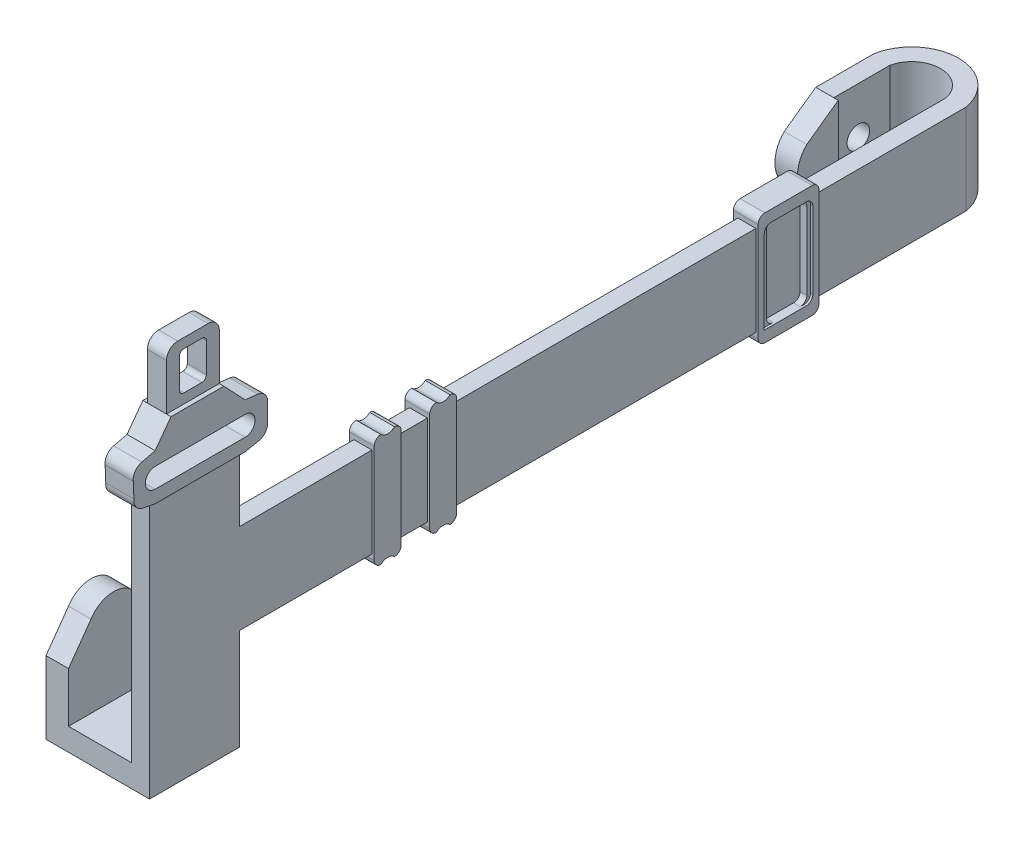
SolidWorks part; units mm, degrees
ref_plane "Alzado" through (0, 0, 0) normal (0, 0, 1) x (1, 0, 0)
ref_plane "Planta" through (0, 0, 0) normal (0, 1, 0) x (1, 0, 0)
ref_plane "Vista lateral" through (0, 0, 0) normal (1, 0, 0) x (0, 0, -1)
sketch "Croquis1" plane through (0, 0, 0) normal (0, 1, 0) x (1, 0, 0)
  line L1 (-25, 0) -> (-25, -25)
  line L2 (0, 0) -> (0, -362) construction
  line L3 (0, 0) -> (0, -362)
  arc A1 (-25, 0) -> (0, 0) centre (-12.5, -2.865) cw
  dimension "D1" = 25
  dimension "D2" = 362
  dimension "D3" = 25
extrude "Extruir-Lámina3" add sketch "Croquis1" along normal blind 40 thin
sketch "Croquis4" plane through (0, 0, 0) normal (0, -1, 0) x (1, 0, 0)
  line L0 (8, 362) -> (0, 362)
  line L1 (0, 362) -> (0, 322)
  line L2 (0, 362) -> (0, 0) construction
  line L3 (0, 322) -> (8, 322)
  line L4 (8, 362) -> (8, -0.7948) construction
  line L5 (8, 322) -> (8, 362)
  dimension "D1" = 40
extrude "Saliente-Extruir1" add sketch "Croquis4" along normal blind 34.88
sketch "Croquis9" plane through (8, 0, 0) normal (1, 0, 0) x (0, 0, -1)
  line L0 (-362, 40) -> (0.7948, 40) construction
  line L5 (-322, 0) -> (0.7948, 0) construction
  line L6 (-65.6135, 0) -> (-92.587, 0) construction
  line L11 (-68.6135, 45) -> (-89.587, 45)
  line L12 (-65.6135, 42) -> (-65.6135, -2)
  line L13 (-68.6135, -5) -> (-89.587, -5)
  line L14 (-92.587, 42) -> (-92.587, -2)
  line L15 (-58.2022, 40) -> (-121.8422, 40) construction
  line L16 (-65.6135, 45) -> (-92.587, -5) construction
  line L17 (-65.6135, -5) -> (-92.587, 45) construction
  line L18 (-212.9826, 40) -> (-273.7346, 40) construction
  line L19 (-71.3109, 40) -> (-86.8897, 40)
  line L20 (-68.3109, 37) -> (-68.3109, 3)
  line L21 (-71.3109, 0) -> (-89.8897, 0)
  line L22 (-89.8897, 37) -> (-89.8897, 0)
  line L24 (-238.5261, 42) -> (-238.5261, -2)
  line L26 (-226.5261, 42) -> (-226.5261, -2)
  line L28 (-251.1805, 42) -> (-251.1805, -2)
  line L30 (-263.1805, 42) -> (-263.1805, -2)
  line L31 (-216.3577, 0) -> (-269.321, 0) construction
  arc A0 (-89.8897, 37) -> (-86.8897, 40) centre (-86.8897, 37) cw
  arc A1 (-68.6135, 45) -> (-65.6135, 42) centre (-68.6135, 42) cw
  arc A2 (-89.587, 45) -> (-92.587, 42) centre (-89.587, 42) ccw
  arc A3 (-92.587, -2) -> (-89.587, -5) centre (-89.587, -2) ccw
  arc A4 (-68.6135, -5) -> (-65.6135, -2) centre (-68.6135, -2) ccw
  arc A5 (-68.3109, 3) -> (-71.3109, 0) centre (-71.3109, 3) cw
  arc A6 (-71.3109, 40) -> (-68.3109, 37) centre (-71.3109, 37) cw
  arc A7 (-260.1805, 45) -> (-263.1805, 42) centre (-260.1805, 42) ccw
  arc A8 (-254.1805, 45) -> (-251.1805, 42) centre (-254.1805, 42) cw
  arc A9 (-263.1805, -2) -> (-260.1805, -5) centre (-260.1805, -2) ccw
  arc A10 (-251.1805, -2) -> (-254.1805, -5) centre (-254.1805, -2) cw
  arc A11 (-238.5261, -2) -> (-235.5261, -5) centre (-235.5261, -2) ccw
  arc A12 (-229.5261, -5) -> (-226.5261, -2) centre (-229.5261, -2) ccw
  arc A13 (-235.5261, 45) -> (-238.5261, 42) centre (-235.5261, 42) ccw
  arc A14 (-229.5261, 45) -> (-226.5261, 42) centre (-229.5261, 42) cw
  arc A15 (-229.5261, -5) -> (-235.5261, -5) centre (-232.5261, -8) ccw
  arc A16 (-254.1805, -5) -> (-260.1805, -5) centre (-257.1805, -8) ccw
  arc A17 (-254.1805, 45) -> (-260.1805, 45) centre (-257.1805, 48) cw
  arc A18 (-235.5261, 45) -> (-229.5261, 45) centre (-232.5261, 48) ccw
  point P42 (-68.3109, 40)
  point P49 (-263.1805, 45)
  point P52 (-251.1805, 45)
  point P63 (-238.5261, 45)
  point P66 (-226.5261, 45)
  dimension "D5" = 3
  dimension "D6" = 3
  dimension "D1" = 12
  dimension "D2" = 12
  dimension "D3" = 50
  dimension "D4" = 5
extrude "Saliente-Extruir4" add sketch "Croquis9" against normal blind 10 and the other way blind 1
sketch "Croquis10" plane through (8, 0, 0) normal (1, 0, 0) x (0, 0, -1)
  line L5 (-72.9197, 40) -> (-84.9197, 40)
  line L6 (-69.9197, 37) -> (-69.9197, 3)
  line L7 (-72.9197, 0) -> (-84.9197, 0)
  line L8 (-87.9197, 37) -> (-87.9197, 3)
  line L9 (-69.9197, 40) -> (-87.9197, 0) construction
  line L10 (-69.9197, 0) -> (-87.9197, 40) construction
  arc A2 (-87.9197, 3) -> (-84.9197, 0) centre (-84.9197, 3) ccw
  arc A3 (-72.9197, 0) -> (-69.9197, 3) centre (-72.9197, 3) ccw
  arc A4 (-84.9197, 40) -> (-87.9197, 37) centre (-84.9197, 37) ccw
  arc A5 (-72.9197, 40) -> (-69.9197, 37) centre (-72.9197, 37) cw
  point P10 (-78.9197, 20)
  dimension "D2" = 3
  dimension "D1" = 18
extrude "Cortar-Extruir1" cut sketch "Croquis10" against normal blind 3
sketch "Croquis16" plane through (0, 40, 0) normal (0, 1, 0) x (1, 0, 0)
  line L0 (0, -362) -> (0, -263.1805) construction
  line L1 (8, -362) -> (0, -362)
  line L2 (8, -362) -> (8, -322)
  line L3 (8, -322) -> (0, -322)
  line L4 (0, -362) -> (0, -322)
  dimension "D1" = 40
extrude "Saliente-Extruir10" add sketch "Croquis16" along normal blind 30
sketch "Croquis19" plane through (-33, 0, 0) normal (-1, 0, 0) x (0, 0, 1)
  circle A0 centre (14.0955, 19.4037) radius 5
  dimension "D1" = 10
extrude "Cortar-Extruir4" cut sketch "Croquis19" against normal blind 10
sketch "Croquis20" plane through (-33, 0, 0) normal (-1, 0, 0) x (0, 0, 1)
  line L0 (39, 30) -> (25, 40)
  line L2 (25, 20) -> (39, 20) construction
  line L3 (25, 40) -> (25, 0) construction
  line L4 (25, 40) -> (25, 0)
  line L5 (25, 0) -> (39, 10)
  arc A0 (39, 30) -> (39, 10) centre (29, 20) cw
  dimension "D1" = 10
  dimension "D2" = 10
  dimension "D3" = 14
extrude "Saliente-Extruir11" add sketch "Croquis20" against normal blind 10
sketch "Croquis29" plane through (8, 0, 0) normal (1, 0, 0) x (0, 0, -1)
  line L0 (-342, 95) -> (-342, 70) construction
  line L1 (-362, 70) -> (-322, 70)
  line L7 (-371.5839, 80) -> (-312, 80) construction
  line L10 (-322, 70) -> (-316.0194, 71.1961)
  line L12 (-312, 76.099) -> (-312, 84.4023)
  line L13 (-312, 80) -> (-312, 88)
  line L14 (-316.4378, 89.3706) -> (-322, 90)
  line L15 (-362, 70) -> (-367.9806, 71.1961)
  line L16 (-371.4417, 76.4996) -> (-371.7261, 83.5004)
  line L17 (-367.9271, 89.0067) -> (-362, 90.4446)
  line L18 (-362, 80) -> (-322, 80) construction
  line L19 (-362, 84.3913) -> (-322, 84.3913)
  line L20 (-362, 75.6087) -> (-322, 75.6087)
  line L21 (-362, 90.4446) -> (-354.9645, 100)
  line L22 (-354.9645, 100) -> (-331.5044, 100)
  line L23 (-331.5044, 100) -> (-322, 90)
  line L24 (-354.9645, 100) -> (-354.9645, 120.5972)
  line L25 (-349.9645, 125.5972) -> (-336.5044, 125.5972)
  line L26 (-331.5044, 120.5972) -> (-331.5044, 100)
  line L27 (-343.2344, 125.5972) -> (-343.2344, 100) construction
  line L28 (-342, 95) -> (-342, 100) construction
  line L29 (-347.2344, 121.2986) -> (-339.2344, 121.2986)
  line L30 (-349.2344, 119.2986) -> (-349.2344, 106.2986)
  line L31 (-347.2344, 104.2986) -> (-339.2344, 104.2986)
  line L32 (-337.2344, 119.2986) -> (-337.2344, 106.2986)
  line L33 (-349.2344, 121.2986) -> (-337.2344, 104.2986) construction
  line L34 (-349.2344, 104.2986) -> (-337.2344, 121.2986) construction
  arc A0 (-312, 84.4023) -> (-316.4378, 89.3706) centre (-317, 84.4023) ccw
  arc A1 (-316.0194, 71.1961) -> (-312, 76.099) centre (-317, 76.099) ccw
  arc A2 (-367.9806, 71.1961) -> (-371.4417, 76.4996) centre (-366.4706, 75.9627) cw
  arc A3 (-371.7261, 83.5004) -> (-367.9271, 89.0067) centre (-366.7676, 84.143) cw
  arc A5 (-362, 84.3913) -> (-362, 75.6087) centre (-362, 80) ccw
  arc A6 (-322, 75.6087) -> (-322, 84.3913) centre (-322, 80) ccw
  arc A7 (-362, 90.4446) -> (-322, 90) centre (-343.4523, -40.4513) cw
  arc A8 (-331.5044, 120.5972) -> (-336.5044, 125.5972) centre (-336.5044, 120.5972) ccw
  arc A9 (-349.9645, 125.5972) -> (-354.9645, 120.5972) centre (-349.9645, 120.5972) ccw
  arc A10 (-339.2344, 104.2986) -> (-337.2344, 106.2986) centre (-339.2344, 106.2986) ccw
  arc A11 (-349.2344, 106.2986) -> (-347.2344, 104.2986) centre (-347.2344, 106.2986) ccw
  arc A12 (-337.2344, 119.2986) -> (-339.2344, 121.2986) centre (-339.2344, 119.2986) ccw
  arc A13 (-349.2344, 119.2986) -> (-347.2344, 121.2986) centre (-347.2344, 119.2986) cw
  point P26 (-342, 80)
  point P37 (-343.2344, 112.7986)
  dimension "D2" = 5
  dimension "D3" = 5
  dimension "D7" = 5
  dimension "D10" = 2
  dimension "D1" = 20
  dimension "D4" = 10
  dimension "D5" = 140
  dimension "D6" = 140
  dimension "D8" = 17
  dimension "D9" = 12
  dimension "D11" = 5
extrude "Saliente-Extruir18" add sketch "Croquis29" along normal blind 2.5 and the other way blind 10 contours A7 L17 A3 L16 A2 L15 L10 A1 L12 A0 L14 A6 L20 A5 L19 M25 | L21 A7 L23 L22 | L25 A9 L24 L22 L26 A8 L30 A13 L29 A12 L32 A10 L31 A11
sketch "Croquis30" plane through (10.5, 0, 0) normal (1, 0, 0) x (0, 0, -1)
  line L0 (-354.9645, 100) -> (-331.5044, 100)
  line L1 (-331.5044, 100) -> (-331.5044, 120.5972)
  line L3 (-336.5044, 125.5972) -> (-349.9645, 125.5972)
  line L4 (-354.9645, 120.5972) -> (-354.9645, 100)
  arc A0 (-336.5044, 125.5972) -> (-331.5044, 120.5972) centre (-336.5044, 120.5972) cw
  arc A1 (-354.9645, 120.5972) -> (-349.9645, 125.5972) centre (-349.9645, 120.5972) cw
  dimension "D1" = 5
  dimension "D2" = 5
extrude "Cortar-Extruir5" cut sketch "Croquis30" against normal blind 2
sketch "Croquis33" plane through (-2, 0, 0) normal (-1, 0, 0) x (0, 0, 1)
  line L0 (331.5044, 100) -> (331.5044, 120.5972)
  line L3 (354.9645, 100) -> (331.5044, 100)
  line L4 (354.9645, 100) -> (354.9645, 120.5972)
  line L5 (336.5044, 125.5972) -> (349.9645, 125.5972)
  arc A0 (349.9645, 125.5972) -> (354.9645, 120.5972) centre (349.9645, 120.5972) cw
  arc A1 (331.5044, 120.5972) -> (336.5044, 125.5972) centre (336.5044, 120.5972) cw
  dimension "D1" = 5
extrude "Cortar-Extruir6" cut sketch "Croquis33" against normal blind 2
sketch "Croquis34" plane through (0, -34.88, 0) normal (0, -1, 0) x (1, 0, 0)
  line L0 (8, 322) -> (-28, 322)
  line L5 (8, 362) -> (-28, 362)
  line L6 (-28, 322) -> (-28, 362)
  line L11 (8, 322) -> (8, 362)
  line L12 (8, 362) -> (0, 362)
  line L13 (0, 362) -> (0, 322)
  line L14 (0, 322) -> (8, 322)
  line L15 (8, 322) -> (8, 362)
  dimension "D1" = 36
  dimension "D2" = 36
  dimension "D3" = 0
extrude "Saliente-Extruir19" add sketch "Croquis34" along normal blind 10
sketch "Croquis35" plane through (-28, 0, 0) normal (-1, 0, 0) x (0, 0, 1)
  line L0 (322, -44.88) -> (322, -12.6399)
  line L1 (362, -44.88) -> (362, -12.6399)
  line L2 (322, -12.6399) -> (362, -12.6399)
  line L7 (362, -34.88) -> (322, -34.88)
  line L8 (322, -34.88) -> (322, -44.88)
  line L9 (322, -44.88) -> (362, -44.88)
  line L10 (362, -44.88) -> (362, -34.88)
  line L13 (322, -44.88) -> (362, -44.88)
  dimension "D1" = 0
extrude "Saliente-Extruir20" add sketch "Croquis35" along normal blind 10
sketch "Croquis38" plane through (-38, 0, 0) normal (-1, 0, 0) x (0, 0, 1)
  line L0 (342, -12.6399) -> (342, 1.3601) construction
  line L1 (362, -12.6399) -> (322, -12.6399) construction
  line L4 (322, -12.6399) -> (332, 1.3601)
  line L5 (362, -12.6399) -> (352, 1.3601)
  line L8 (322, -44.88) -> (362, -44.88)
  line L9 (362, -44.88) -> (362, -12.6399)
  line L10 (362, -12.6399) -> (322, -12.6399)
  line L11 (322, -12.6399) -> (322, -44.88)
  line L12 (322, -44.88) -> (362, -44.88)
  line L13 (362, -44.88) -> (362, -12.6399)
  line L15 (322, -12.6399) -> (322, -44.88)
  arc A0 (332, 1.3601) -> (352, 1.3601) centre (342, -4.8248) cw
  dimension "D1" = 14
  dimension "D2" = 10
  dimension "D3" = 10
  dimension "D4" = 0
extrude "Saliente-Extruir21" add sketch "Croquis38" against normal blind 10
